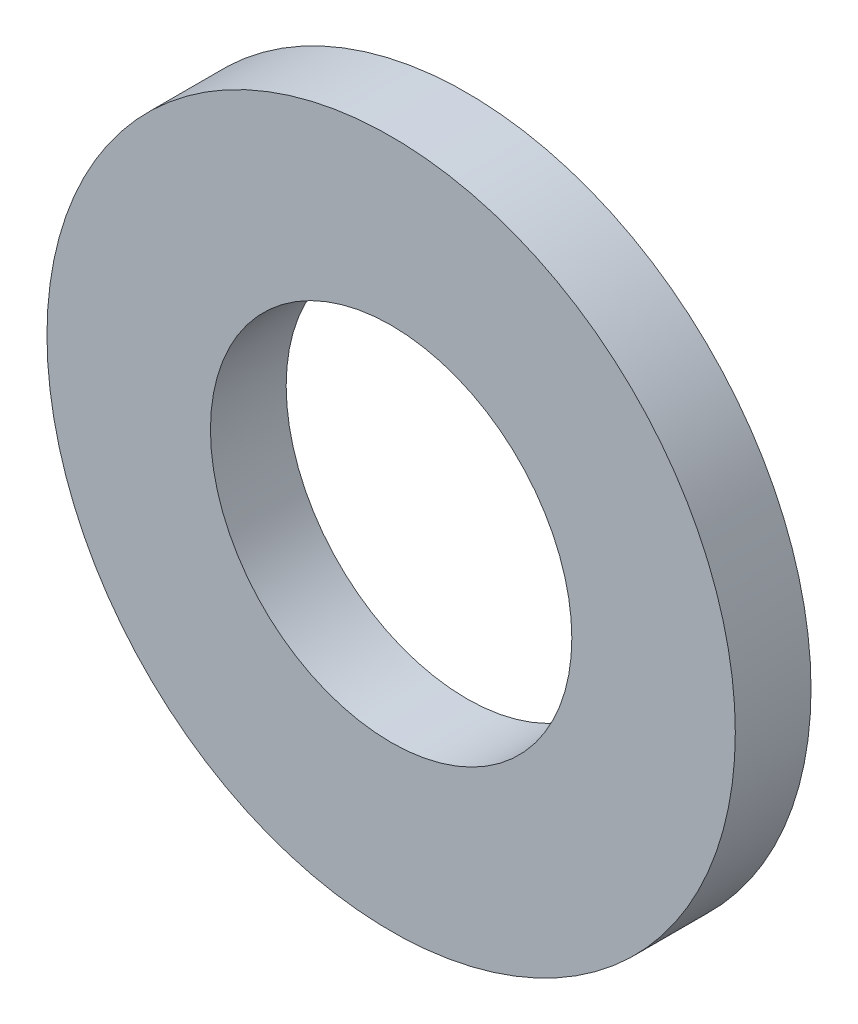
SolidWorks part; units mm, degrees
ref_plane "Front Plane" through (0, 0, 0) normal (0, 0, 1) x (1, 0, 0)
ref_plane "Top Plane" through (0, 0, 0) normal (0, 1, 0) x (1, 0, 0)
ref_plane "Right Plane" through (0, 0, 0) normal (1, 0, 0) x (0, 0, -1)
sketch "Sketch1" plane through (0, 0, 0) normal (0, 0, 1) x (1, 0, 0)
  circle A0 centre (0, 0) radius 10
  circle A1 centre (0, 0) radius 5.25
  dimension "OD" = 20
  dimension "ID1" = 10.5
extrude "Boss-Extrude1" add sketch "Sketch1" along normal blind 2.2
